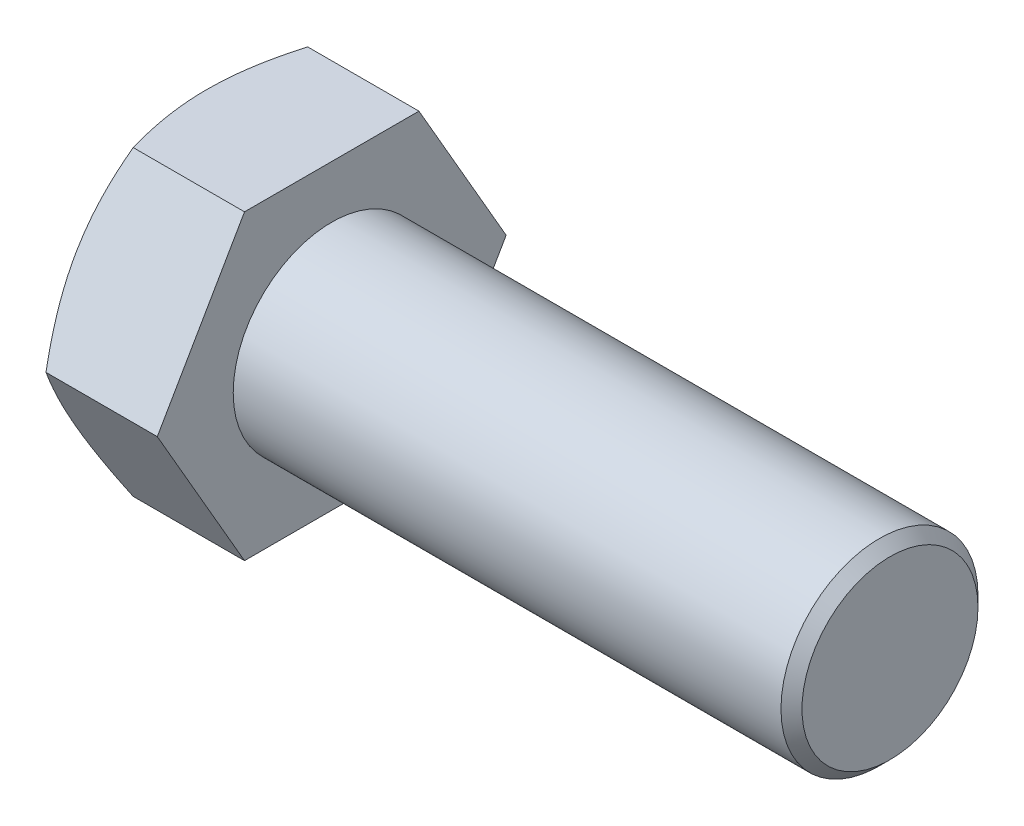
SolidWorks part; units mm, degrees
ref_plane "Plan1" through (0, 0, 0) normal (0, 0, 1) x (1, 0, 0)
ref_plane "Plan2" through (0, 0, 0) normal (0, 1, 0) x (1, 0, 0)
ref_plane "Plan3" through (0, 0, 0) normal (1, 0, 0) x (0, 0, -1)
sketch "Esquisse1" plane through (0, 0, 0) normal (0, 1, 0) x (1, 0, 0)
  line L0 (0, 0) -> (85, 0)
  line L1 (0, 0) -> (0, 15)
  line L2 (85, 15) -> (0, 15)
  line L3 (85, 15) -> (85, 0)
  line L4 (0, 0) -> (85, 0) construction
revolve "Base-Révolution" add sketch "Esquisse1" angle 360 about L4
chamfer "Chanfrein1" distance 1.6 angle 45 1 edges at (85, 0, 15)
sketch "Esquisse6" plane through (0, 0, 0) normal (1, 0, 0) x (0, -1, 0)
  line L0 (0, 0) -> (26.5581, 0) construction
  line L1 (0, 0) -> (23, 13.2791) construction
  line L2 (23, -13.2791) -> (23, 13.2791)
  line L3 (0, 0) -> (0, 26.5581) construction
  line L4 (23, 13.2791) -> (0, 26.5581)
  line L5 (23, -13.2791) -> (0, -26.5581)
  line L6 (-23, 13.2791) -> (0, 26.5581)
  line L7 (-23, -13.2791) -> (0, -26.5581)
  line L8 (-23, -13.2791) -> (-23, 13.2791)
  circle A0 centre (0, 0) radius 23 construction
  circle A1 centre (0, 0) radius 26.5581 construction
  point P8 (23, 0)
  dimension "D1" = 46
  dimension "D2" = 30
extrude "Boss.-Extru.1" add sketch "Esquisse6" against normal blind 19
sketch "Esquisse7" plane through (0, 0, 0) normal (0, 0, 1) x (1, 0, 0)
  line L0 (-19, 23) -> (-19, 55.909)
  line L1 (-19, 55.909) -> (0, 55.909)
  line L2 (0, 55.909) -> (-19, 23)
  line L3 (0, 0) -> (-19, 0) construction
  dimension "D1" = 30
revolve "Enlever de la matière-Révolution1" cut sketch "Esquisse7" angle 360 about L3
equation "\"D1@Chanfrein1\"= 0.2 * \"D2@Esquisse1\""
